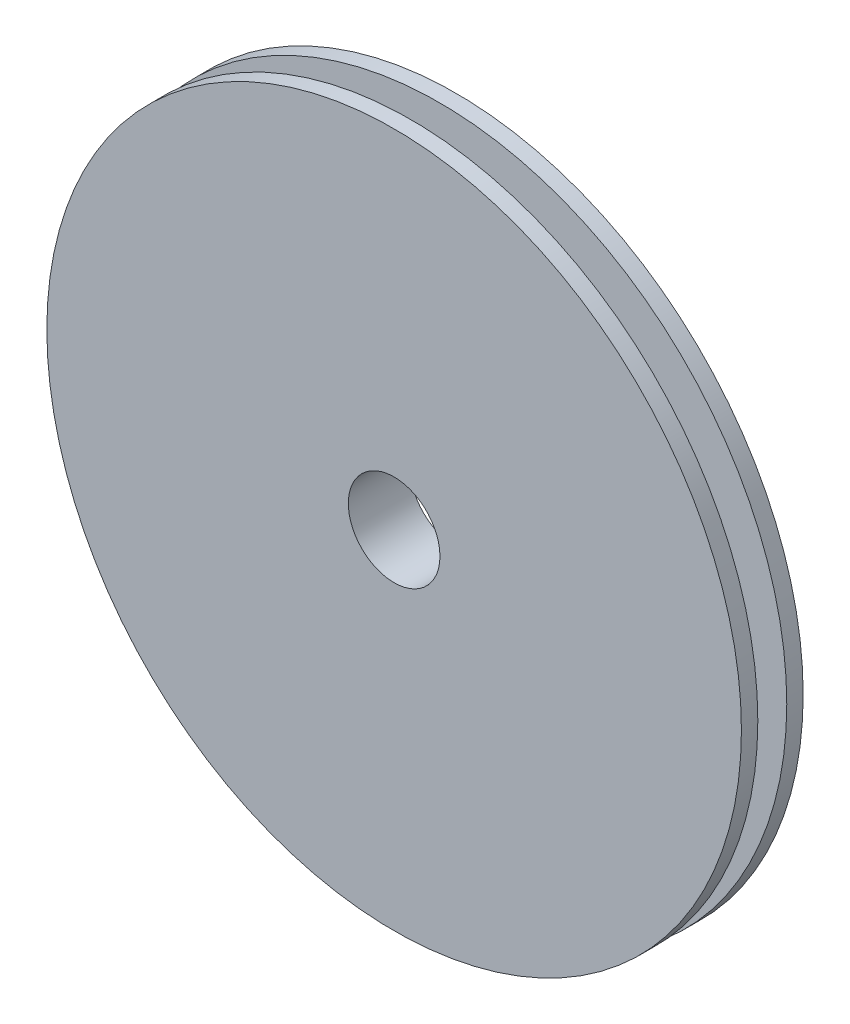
SolidWorks part; units mm, degrees
ref_plane "Front Plane" through (0, 0, 0) normal (0, 0, 1) x (1, 0, 0)
ref_plane "Top Plane" through (0, 0, 0) normal (0, 1, 0) x (1, 0, 0)
ref_plane "Right Plane" through (0, 0, 0) normal (1, 0, 0) x (0, 0, -1)
sketch "Sketch1" plane through (0, 0, 0) normal (0, 0, 1) x (1, 0, 0)
  circle A0 centre (0, 0) radius 18
  dimension "D1" = 36
extrude "Boss-Extrude1" add sketch "Sketch1" along normal blind 3.2
sketch "Sketch2" plane through (0, 0, 3.2) normal (0, 0, 1) x (1, 0, 0)
  circle A0 centre (0, 0) radius 2.375
  dimension "D1" = 4.75
extrude "Cut-Extrude1" cut sketch "Sketch2" against normal blind 43 and the other way blind 17
ref_plane "Plane1" through (0, 0, 1.6) normal (0, 0, 1) x (1, 0, 0)
sketch "Sketch5" plane through (0, 0, 1.6) normal (0, 0, 1) x (1, 0, 0)
  circle A0 centre (0, 0) radius 18
  circle A1 centre (0, 0) radius 15.5
  dimension "D1" = 2.5
  dimension "D2" = 36
extrude "Cut-Extrude4" cut sketch "Sketch5" against normal mid plane 1.5 contours A0 | A1
